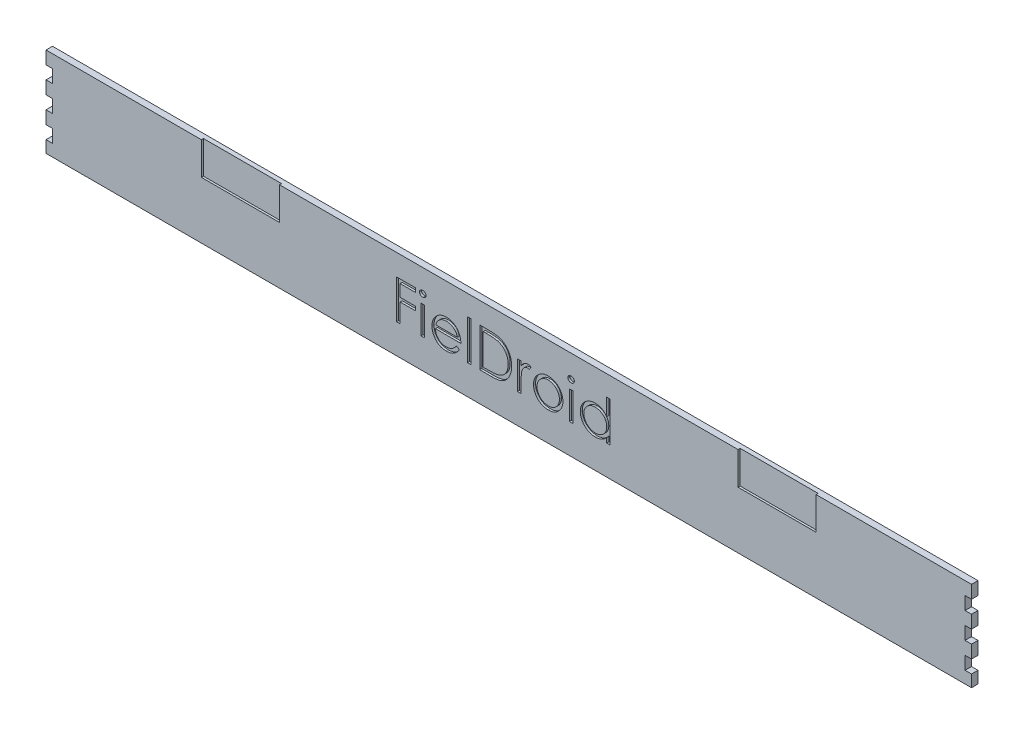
SolidWorks part; units mm, degrees
ref_plane "Front Plane" through (0, 0, 0) normal (0, 0, 1) x (1, 0, 0)
ref_plane "Top Plane" through (0, 0, 0) normal (0, 1, 0) x (1, 0, 0)
ref_plane "Right Plane" through (0, 0, 0) normal (1, 0, 0) x (0, 0, -1)
sketch "Sketch1" plane through (0, 0, 0) normal (0, 0, 1) x (1, 0, 0)
  line L0 (0, 0) -> (0, 5.842)
  line L1 (0, 43.942) -> (454.025, 43.942)
  line L2 (454.025, 18.542) -> (454.025, 12.192) construction
  line L3 (454.025, 0) -> (0, 0)
  line L4 (0, 43.942) -> (0, 37.592) construction
  line L5 (0, 37.592) -> (3.175, 37.592)
  line L6 (3.175, 37.592) -> (3.175, 31.242)
  line L7 (3.175, 31.242) -> (0, 31.242)
  line L8 (0, 31.242) -> (0, 24.892) construction
  line L9 (0, 24.892) -> (3.175, 24.892)
  line L10 (3.175, 24.892) -> (3.175, 18.542)
  line L11 (3.175, 18.542) -> (0, 18.542)
  line L12 (0, 18.542) -> (0, 12.192) construction
  line L13 (0, 12.192) -> (3.175, 12.192)
  line L14 (3.175, 12.192) -> (3.175, 5.842)
  line L15 (3.175, 5.842) -> (0, 5.842)
  line L16 (0, 37.592) -> (0, 43.942)
  line L17 (0, 24.892) -> (0, 31.242)
  line L18 (0, 12.192) -> (0, 18.542)
  line L19 (227.0125, 43.942) -> (227.0125, -9.0924) construction
  line L20 (454.025, 31.242) -> (454.025, 24.892) construction
  line L21 (454.025, 43.942) -> (454.025, 37.592) construction
  line L22 (454.025, 12.192) -> (454.025, 18.542)
  line L23 (454.025, 24.892) -> (454.025, 31.242)
  line L24 (454.025, 37.592) -> (454.025, 43.942)
  line L25 (450.85, 5.842) -> (454.025, 5.842)
  line L26 (450.85, 12.192) -> (450.85, 5.842)
  line L27 (454.025, 12.192) -> (450.85, 12.192)
  line L28 (450.85, 18.542) -> (454.025, 18.542)
  line L29 (450.85, 24.892) -> (450.85, 18.542)
  line L30 (454.025, 24.892) -> (450.85, 24.892)
  line L31 (450.85, 31.242) -> (454.025, 31.242)
  line L32 (450.85, 37.592) -> (450.85, 31.242)
  line L33 (454.025, 37.592) -> (450.85, 37.592)
  line L34 (454.025, 0) -> (454.025, 5.842)
  dimension "D1" = 43.942
  dimension "D2" = 454.025
  dimension "D3" = 3.175
  dimension "D4" = 6.35
  dimension "D5" = 6.35
extrude "Boss-Extrude1" add sketch "Sketch1" along normal blind 3.175
sketch "Sketch2" plane through (0, 0, 3.175) normal (0, 0, 1) x (1, 0, 0)
  line L0 (0, 43.942) -> (76.2, 43.942) construction
  line L1 (454.025, 43.942) -> (0, 43.942) construction
  line L2 (76.2, 43.942) -> (76.2, 27.94)
  line L3 (76.2, 27.94) -> (114.554, 27.94)
  line L4 (114.554, 27.94) -> (114.554, 43.942)
  line L5 (114.554, 43.942) -> (76.2, 43.942)
  line L6 (227.0125, 43.942) -> (227.0125, -13.5481) construction
  line L7 (339.471, 43.942) -> (377.825, 43.942)
  line L8 (339.471, 27.94) -> (339.471, 43.942)
  line L9 (377.825, 27.94) -> (339.471, 27.94)
  line L10 (377.825, 43.942) -> (377.825, 27.94)
  dimension "D1" = 76.2
  dimension "D2" = 16.002
  dimension "D3" = 38.354
extrude "Cut-Extrude1" cut sketch "Sketch2" against normal blind 1.016
sketch "Sketch3" plane through (0, 0, 3.175) normal (0, 0, 1) x (1, 0, 0)
  text T0 "FielDroid" font "Century Gothic" height in points 72
extrude "Cut-Extrude2" cut sketch "Sketch3" against normal blind 1.016
sketch "Sketch4" plane through (0, 0, 3.175) normal (0, 0, 1) x (1, 0, 0)
